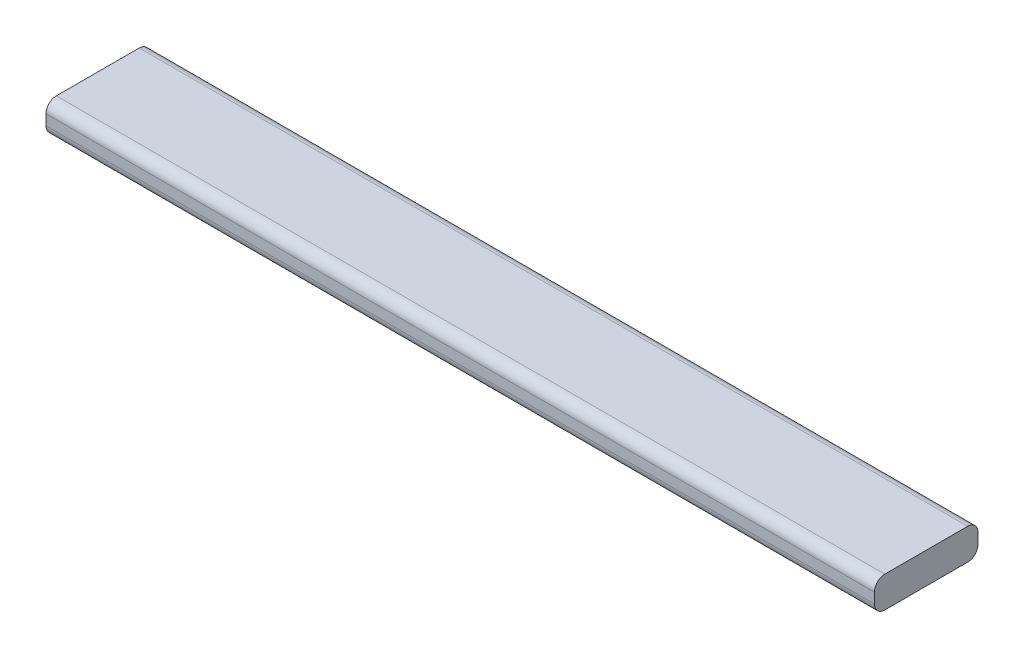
SolidWorks part; units mm, degrees
ref_plane "Bottom Plane" through (0, 0, 0) normal (0, 0, 1) x (1, 0, 0)
ref_plane "Front Plane" through (0, 0, 0) normal (0, 1, 0) x (1, 0, 0)
ref_plane "Left Plane" through (0, 0, 0) normal (1, 0, 0) x (0, 0, -1)
ref_plane "Right Plane" through (508, 0, 0) normal (1, 0, 0) x (0, 0, -1)
ref_plane "Back Plane" through (0, 19.05, 0) normal (0, 1, 0) x (1, 0, 0)
ref_plane "Top Plane" through (0, 0, 139.7) normal (0, 0, 1) x (1, 0, 0)
sketch "Sketch2" plane through (0, 0, 0) normal (1, 0, 0) x (0, 0, -1)
  line L1 (0, 0) -> (-63.5, 0)
  line L2 (0, 0) -> (0, 19.05)
  line L3 (0, 19.05) -> (-63.5, 19.05)
  line L4 (-63.5, 0) -> (-63.5, 19.05)
  dimension "D1" = 19.05
  dimension "D2" = 63.5
extrude "Boss-Extrude1" add sketch "Sketch2" along normal up to surface (508 mm away)
ref_plane "half length" through (254, 0, 0) normal (1, 0, 0) x (0, 0, -1)
ref_plane "Half Width" through (0, 0, 69.85) normal (0, 0, 1) x (1, 0, 0)
fillet "Fillet1" radius 6.35 4 edges at (254, 19.05, 63.5) (254, 19.05, 0) (254, 0, 0) (254, 0, 63.5)
